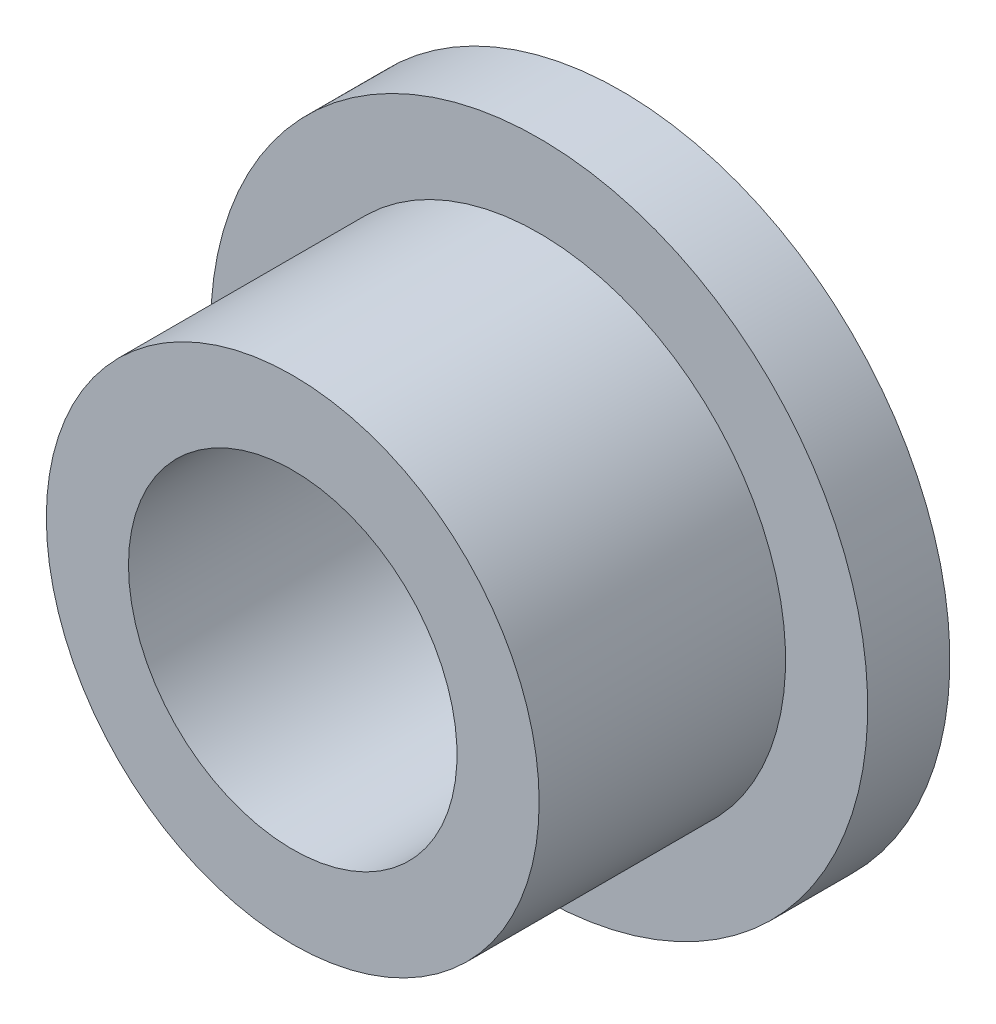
SolidWorks part; units mm, degrees
ref_plane "Front" through (0, 0, 0) normal (0, 0, 1) x (1, 0, 0)
ref_plane "Top" through (0, 0, 0) normal (0, 1, 0) x (1, 0, 0)
ref_plane "Right" through (0, 0, 0) normal (1, 0, 0) x (0, 0, -1)
sketch "Sketch1" plane through (0, 0, 0) normal (0, 0, 1) x (1, 0, 0)
  circle A0 centre (0, 0) radius 15
extrude "Extrude1" add sketch "Sketch1" along normal blind 15
sketch "Sketch2" plane through (0, 0, 0) normal (0, 0, -1) x (-1, 0, 0)
  circle A0 centre (0, 0) radius 20
extrude "Extrude2" add sketch "Sketch2" along normal blind 5
sketch "Sketch3" plane through (0, 0, -5) normal (0, 0, -1) x (-1, 0, 0)
  circle A0 centre (0, 0) radius 10
extrude "Cut-Extrude1" cut sketch "Sketch3" against normal through all
